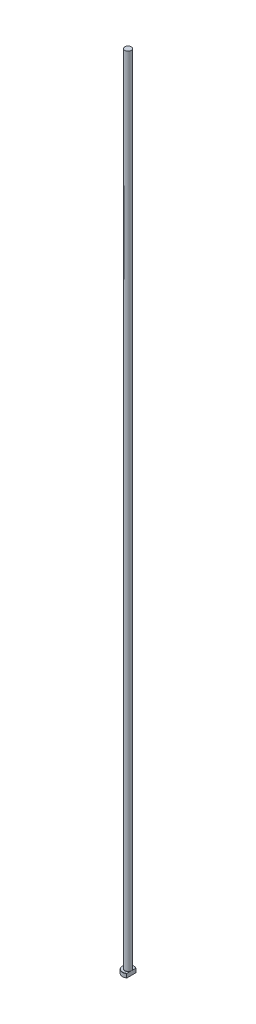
SolidWorks part; units mm, degrees
ref_plane "Front Plane" through (0, 0, 0) normal (0, 0, 1) x (1, 0, 0)
ref_plane "Top Plane" through (0, 0, 0) normal (0, 1, 0) x (1, 0, 0)
ref_plane "Right Plane" through (0, 0, 0) normal (1, 0, 0) x (0, 0, -1)
sketch "Sketch1" plane through (0, 0, 0) normal (0, 0, 1) x (1, 0, 0)
  line L0 (0, 259.9588) -> (0, -15.1925) construction
  line L1 (0, 0) -> (-7, 0)
  line L2 (-7, 0) -> (-7, 5)
  line L3 (-7, 5) -> (-4, 5)
  line L4 (-4, 5) -> (-4, 1000)
  line L5 (-4, 1000) -> (0, 1000)
  line L6 (0, 1000) -> (0, 0)
  dimension "L" = 1000
  dimension "H" = 14
  dimension "T" = 5
  dimension "D" = 8
revolve "Revolve1" add sketch "Sketch1" angle 360 about L0
chamfer "Chamfer1" distance 0.2 angle 45 2 edges at (0, 5, 7) (0, 0, 7)
fillet "Fillet1" radius 0.2 1 edges at (0, 5, 4)
sketch "Sketch2" plane through (0, 0, 0) normal (0, 1, 0) x (1, 0, 0)
  line L0 (4, 5.7446) -> (4, -5.7446)
  circle A0 centre (0, 0) radius 7 construction
  arc A1 (4, -5.7446) -> (4, 5.7446) centre (0, 0) ccw
  circle A2 centre (0, 0) radius 4 construction
extrude "KEY" cut sketch "Sketch2" along normal through all
